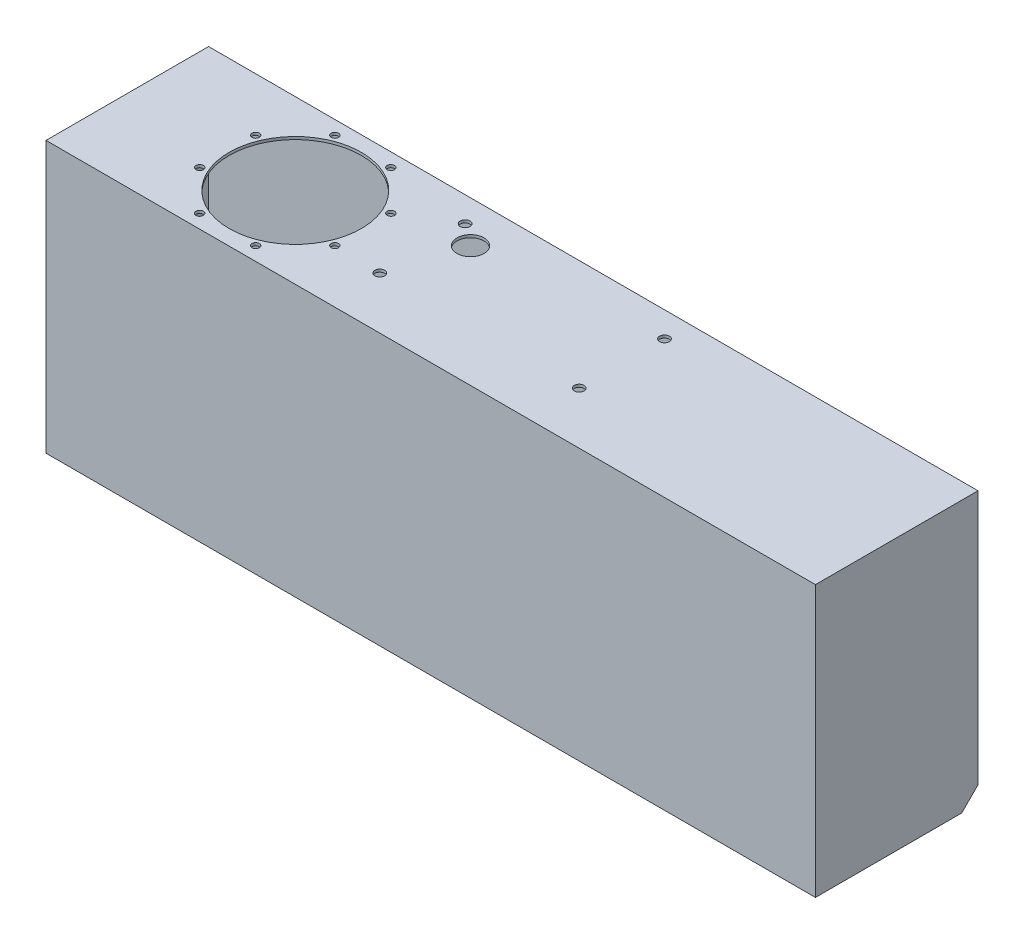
SolidWorks part; units mm, degrees
ref_plane "Face" through (0, 0, 0) normal (0, 0, 1) x (1, 0, 0)
ref_plane "Dessus" through (0, 0, 0) normal (0, 1, 0) x (1, 0, 0)
ref_plane "Droite" through (0, 0, 0) normal (1, 0, 0) x (0, 0, -1)
sketch "Esquisse1" plane through (0, 0, 0) normal (0, 0, 1) x (1, 0, 0)
  line L1 (0, 0) -> (710, 0)
  line L2 (0, 0) -> (0, 250)
  line L3 (0, 250) -> (710, 250)
  line L4 (710, 0) -> (710, 250)
  dimension "D1" = 710
  dimension "D2" = 250
extrude "Extrusion1" add sketch "Esquisse1" along normal blind 2.5
sketch "Esquisse2" plane through (0, 0, 2.5) normal (0, 0, 1) x (1, 0, 0)
  line L0 (0, 0) -> (710, 0) construction
  line L1 (0, 250) -> (0, 0) construction
  line L2 (710, 250) -> (0, 250) construction
  line L3 (710, 0) -> (710, 250) construction
  line L4 (0, 0) -> (710, 0)
  line L5 (0, 250) -> (0, 0)
  line L6 (710, 250) -> (0, 250)
  line L7 (710, 0) -> (710, 250)
  line L8 (2.5, 2.5) -> (707.5, 2.5)
  line L9 (707.5, 2.5) -> (707.5, 247.5)
  line L10 (707.5, 247.5) -> (2.5, 247.5)
  line L11 (2.5, 247.5) -> (2.5, 2.5)
  dimension "D1" = 2.5
extrude "Extrusion2" add sketch "Esquisse2" along normal blind 145
chamfer "Chanfrein1" distance 15 angle 45 1 edges at (355, 2.5, 2.5)
chamfer "Chanfrein2" distance 15 angle 45 1 edges at (355, 0, 0)
sketch "Esquisse3" plane through (0, 0, 147.5) normal (0, 0, 1) x (1, 0, 0)
  line L0 (0, 0) -> (710, 0) construction
  line L1 (710, 0) -> (710, 250) construction
  line L2 (0, 250) -> (0, 0) construction
  line L3 (710, 250) -> (0, 250) construction
  line L4 (0, 0) -> (710, 0)
  line L5 (710, 0) -> (710, 250)
  line L6 (0, 250) -> (0, 0)
  line L7 (710, 250) -> (0, 250)
extrude "Extrusion3" add sketch "Esquisse3" along normal blind 2.5
sketch "Esquisse4" plane through (0, 0, 0) normal (0, -1, 0) x (1, 0, 0)
  line L0 (0, 150) -> (0, 15) construction
  line L2 (710, 0) -> (0, 0) construction
  circle A0 centre (70, 23) radius 6.5
  dimension "D1" = 13
  dimension "D2" = 70
  dimension "D3" = 23
extrude "Enlèv. mat.-Extru.1" cut sketch "Esquisse4" against normal blind 25
sketch "Esquisse5" plane through (0, 250, 0) normal (0, 1, 0) x (-1, 0, 0)
  line L0 (0, 150) -> (0, 0) construction
  line L1 (-710, 0) -> (0, 0) construction
  line L2 (-155, 75) -> (-155, -27.0341) construction
  line L3 (-260, 102) -> (-444, 102) construction
  line L4 (-260, 102) -> (-260, 23.2733) construction
  circle A0 centre (-155, 75) radius 61
  circle A1 centre (-260, 102) radius 4.5
  circle A2 centre (-444, 102) radius 4.5
  circle A3 centre (-260, 23.2733) radius 4.5
  circle A4 centre (-444, 23.2733) radius 4.5
  circle A5 centre (-280, 38.2733) radius 12.5
  dimension "D1" = 122
  dimension "D4" = 9
  dimension "D8" = 25
  dimension "D2" = 155
  dimension "D3" = 75
  dimension "D5" = 105
  dimension "D6" = 27
  dimension "D7" = 90
  dimension "D9" = 20
  dimension "D10" = 15
extrude "Enlèv. mat.-Extru.2" cut sketch "Esquisse5" against normal blind 25
ref_plane "Plan1" through (255, 0, 0) normal (1, 0, 0) x (0, 0, -1)
sketch "Esquisse6" plane through (255, 0, 0) normal (1, 0, 0) x (0, 0, -1)
  line L0 (-23, 0) -> (-55.7479, 56.721) construction
  line L1 (0, 250) -> (0, 15) construction
  line L2 (-150, 0) -> (-15, 0) construction
  line L3 (-59.5535, 38.3126) -> (-31.2289, -10.7472)
  line L4 (-59.5535, 38.3126) -> (-48.7282, 44.5626)
  line L5 (-48.7282, 44.5626) -> (-15.1871, -13.5323)
  line L6 (-15.1871, -13.5323) -> (-31.2289, -10.7472)
  dimension "D1" = 30
  dimension "D2" = 23
  dimension "D3" = 12.5
revolve "Enlèvement de matière-Révolution1" cut sketch "Esquisse6" angle 360 about L0
hole_wizard "Trou taraudé M10x1.51" positions "Esquisse9" profile "Esquisse8" tap size "M10x1.5" standard "Ansi Métrique"
sketch "Esquisse9" plane through (0, 0, 0) normal (-1, 0, 0) x (0, 0, 1)
  line L0 (150, 250) -> (0, 250) construction
  line L1 (150, 250) -> (150, 0) construction
  point P0 (120, 220)
  point P6 (120, 144)
  dimension "D1" = 30
  dimension "D2" = 30
  dimension "D3" = 30
  dimension "D4" = 76
sketch "Esquisse8" plane through (0, 220, 120) normal (0, 1, 0) x (0, 0, 1)
  line L0 (0, 0) -> (0, 27.0537)
  line L1 (0, 27.0537) -> (4.25, 24.5)
  line L2 (4.25, 24.5) -> (4.25, 0)
  line L5 (4.25, 0) -> (0, 0)
  line L10 (0, 27.0537) -> (-4.25, 24.5) construction
  line L11 (0, -6.35) -> (0, 107.95) construction
  dimension "Diamètre du trou pour taraudage" = 8.5
  dimension "Profondeur du trou pour taraudage" = 24.5
  dimension "Angle de pointe" = 118
hole_wizard "Trou taraudé M8x1.251" positions "Esquisse11" profile "Esquisse10" tap size "M8x1.25" standard "Ansi Métrique"
sketch "Esquisse11" plane through (0, 250, 0) normal (0, 1, 0) x (-1, 0, 0)
  line L0 (-155, 75) -> (-155, -16.9987) construction
  line L2 (-155, 75) -> (-180.8311, 12.6381) construction
  point P0 (-180.8311, 12.6381)
  dimension "D1" = 22.5
  dimension "D2" = 67.5
sketch "Esquisse10" plane through (180.8311, 250, 12.6381) normal (1, 0, 0) x (0, 0, 1)
  line L0 (0, 0) -> (0, 21.7929)
  line L1 (0, 21.7929) -> (3.4, 19.75)
  line L2 (3.4, 19.75) -> (3.4, 0)
  line L5 (3.4, 0) -> (0, 0)
  line L10 (0, 21.7929) -> (-3.4, 19.75) construction
  line L11 (0, -6.35) -> (0, 107.95) construction
  dimension "Diamètre du trou pour taraudage" = 6.8
  dimension "Profondeur du trou pour taraudage" = 19.75
  dimension "Angle de pointe" = 118
pattern_circular "Répétition circulaire1" count 8 over 360 about axis through (155, 0, 75) along (0, 1, 0) of "Trou taraudé M8x1.251"
